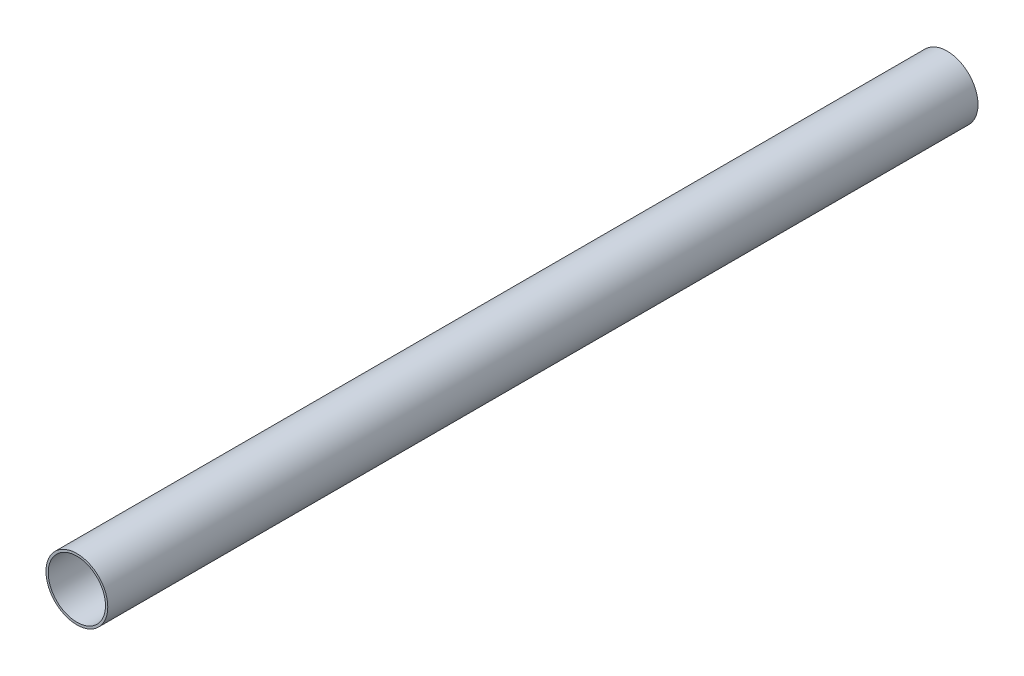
SolidWorks part; units mm, degrees
ref_plane "Plano frontal" through (0, 0, 0) normal (0, 0, 1) x (1, 0, 0)
ref_plane "Plano superior" through (0, 0, 0) normal (0, 1, 0) x (1, 0, 0)
ref_plane "Plano direito" through (0, 0, 0) normal (1, 0, 0) x (0, 0, -1)
sketch "Esboço1" plane through (0, 0, 0) normal (0, 0, 1) x (1, 0, 0)
  circle A0 centre (0, 0) radius 27
  circle A1 centre (0, 0) radius 25
surface "Superfície-Extrusão1" sketch "Esboço1" parameters "D1"=380, "D2"=380
